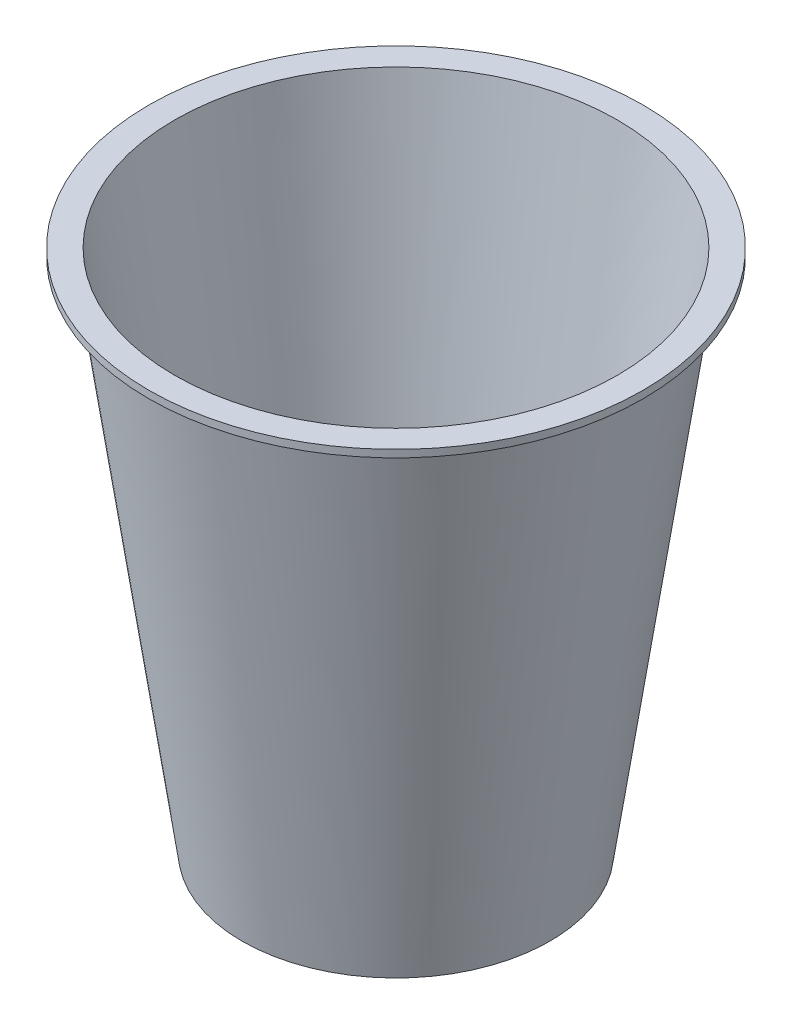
SolidWorks part; units mm, degrees
ref_plane "Face" through (0, 0, 0) normal (0, 0, 1) x (1, 0, 0)
ref_plane "Dessus" through (0, 0, 0) normal (0, 1, 0) x (1, 0, 0)
ref_plane "Droite" through (0, 0, 0) normal (1, 0, 0) x (0, 0, -1)
sketch "Esquisse1" plane through (0, 0, 0) normal (0, 0, 1) x (1, 0, 0)
  line L0 (0, 0) -> (0, 80.4999) construction
  line L1 (-33.5, 70) -> (-30, 70)
  line L2 (-30, 70) -> (-20, 0)
  line L3 (-20, 0) -> (0, 0)
  dimension "D1" = 33.5
  dimension "D2" = 30
  dimension "D3" = 70
  dimension "D4" = 20
revolve "Base-Révol.-Mince" add sketch "Esquisse1" angle 360 about L0
